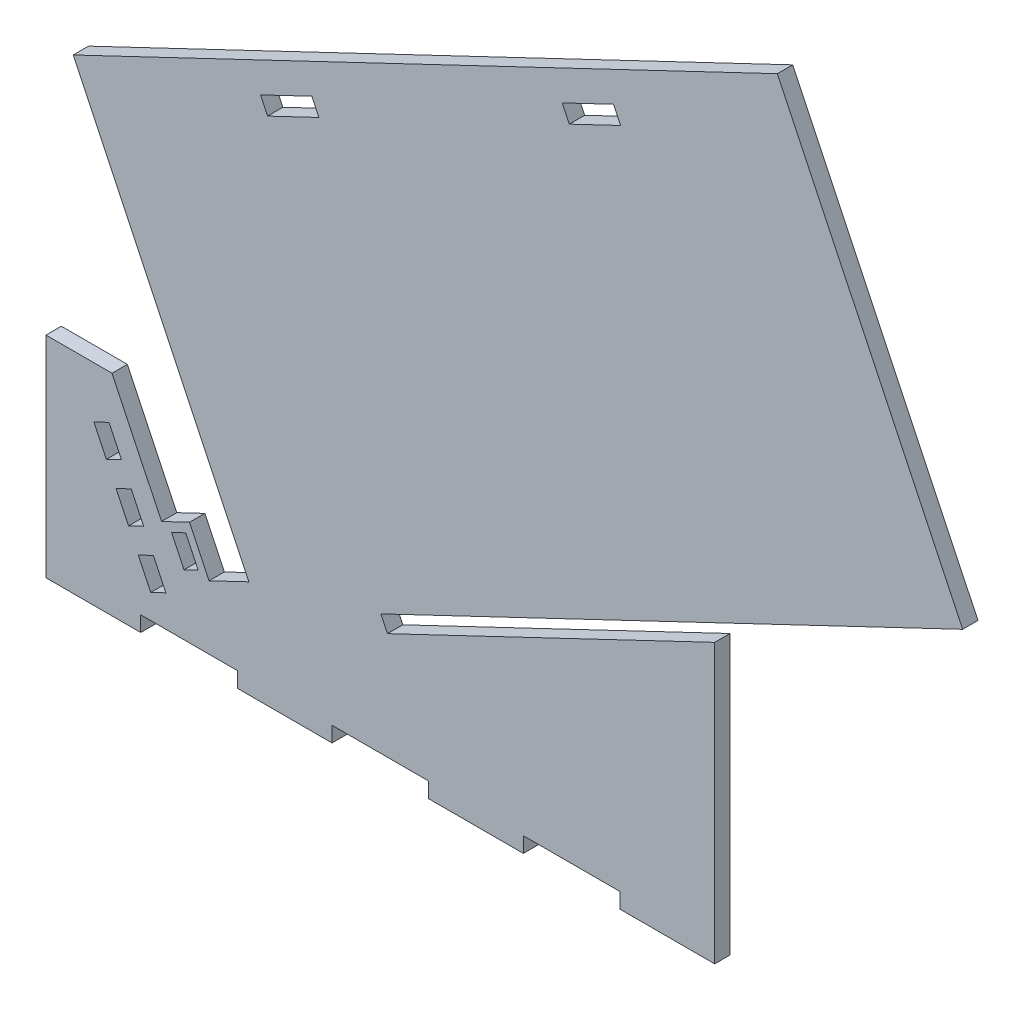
SolidWorks part; units mm, degrees
ref_plane "Front Plane" through (0, 0, 0) normal (0, 0, 1) x (1, 0, 0)
ref_plane "Top Plane" through (0, 0, 0) normal (0, 1, 0) x (1, 0, 0)
ref_plane "Right Plane" through (0, 0, 0) normal (1, 0, 0) x (0, 0, -1)
sketch "Sketch1" plane through (0, 0, 0) normal (0, 0, 1) x (1, 0, 0)
  line L12 (-264.2572, -95.6581) -> (-230.2572, -95.6581)
  line L13 (-230.2572, -95.6581) -> (-230.2572, -90.1581)
  line L15 (-264.2572, -90.1581) -> (-264.2572, -95.6581)
  line L24 (-241.7419, -36.2998) -> (-237.4367, -45.3257)
  line L25 (-237.4367, -45.3257) -> (-242.4912, -47.7366)
  line L26 (-242.4912, -47.7366) -> (-246.7963, -38.7107)
  line L27 (-246.7963, -38.7107) -> (-241.7419, -36.2998)
  line L28 (-233.7774, -52.9977) -> (-229.4723, -62.0235)
  line L29 (-229.4723, -62.0235) -> (-234.5268, -64.4344)
  line L30 (-234.5268, -64.4344) -> (-238.8319, -55.4085)
  line L31 (-238.8319, -55.4085) -> (-233.7774, -52.9977)
  line L32 (-225.8129, -69.6955) -> (-221.5078, -78.7214)
  line L33 (-221.5078, -78.7214) -> (-226.5623, -81.1322)
  line L34 (-226.5623, -81.1322) -> (-230.8674, -72.1064)
  line L35 (-230.8674, -72.1064) -> (-225.8129, -69.6955)
  line L44 (-195.5972, -95.6581) -> (-161.5972, -95.6581)
  line L45 (-195.5972, -90.1581) -> (-195.5972, -95.6581)
  line L47 (-161.5972, -95.6581) -> (-161.5972, -90.1581)
  line L52 (-24.2572, -95.6581) -> (-58.2572, -95.6581)
  line L53 (-58.2572, -95.6581) -> (-58.2572, -90.1581)
  line L55 (-24.2572, -90.1581) -> (-24.2572, -95.6581)
  line L56 (-92.9172, -95.6581) -> (-126.9172, -95.6581)
  line L57 (-126.9172, -95.6581) -> (-126.9172, -90.1581)
  line L59 (-92.9172, -90.1581) -> (-92.9172, -95.6581)
  line L61 (-264.2572, -90.1581) -> (-264.2572, -20.2081)
  line L62 (-264.2572, -20.2081) -> (-240.5538, -20.2081)
  line L63 (-240.5538, -20.2081) -> (-222.803, -57.4233)
  line L64 (-205.7276, -67.3141) -> (-191.4252, -60.4922)
  line L65 (-191.4252, -60.4922) -> (-254.494, 71.7343)
  line L66 (-230.2572, -90.1581) -> (-195.5972, -90.1581)
  line L67 (-161.5972, -90.1581) -> (-126.9172, -90.1581)
  line L68 (-58.2572, -90.1581) -> (-92.9172, -90.1581)
  line L70 (-254.494, 71.7343) -> (-1.7701, 192.2774)
  line L71 (-219.5762, -82.783) -> (-144.0813, -46.7738) construction
  line L80 (-78.6977, 144.5056) -> (-60.646, 153.1158)
  line L81 (-60.646, 153.1158) -> (-58.2782, 148.1516)
  line L82 (-58.2782, 148.1516) -> (-76.3299, 139.5414)
  line L83 (-76.3299, 139.5414) -> (-78.6977, 144.5056)
  line L84 (-187.0079, 92.8442) -> (-168.9562, 101.4545)
  line L85 (-168.9562, 101.4545) -> (-166.5884, 96.4902)
  line L86 (-166.5884, 96.4902) -> (-184.6401, 87.88)
  line L87 (-184.6401, 87.88) -> (-187.0079, 92.8442)
  line L88 (-24.2572, -90.1581) -> (-24.2572, 4.2831)
  line L89 (-144.0757, -46.7738) -> (-141.7079, -51.738)
  line L92 (-141.7079, -51.738) -> (-24.2572, 4.2831)
  line L93 (-144.0757, -46.7738) -> (64.7438, 52.828)
  line L94 (64.7438, 52.828) -> (-1.7701, 192.2774)
  line L106 (-237.1701, -45.4201) -> (-242.5856, -48.0032)
  line L107 (-242.5856, -48.0032) -> (-247.063, -38.6163)
  line L108 (-247.063, -38.6163) -> (-241.6474, -36.0332)
  line L109 (-241.6474, -36.0332) -> (-237.1701, -45.4201)
  line L110 (-229.2057, -62.1179) -> (-234.6212, -64.701)
  line L111 (-234.6212, -64.701) -> (-239.0985, -55.3141)
  line L112 (-239.0985, -55.3141) -> (-233.683, -52.7311)
  line L113 (-233.683, -52.7311) -> (-229.2057, -62.1179)
  line L114 (-231.134, -72.012) -> (-225.7185, -69.4289)
  line L115 (-225.7185, -69.4289) -> (-221.2412, -78.8158)
  line L116 (-221.2412, -78.8158) -> (-226.6567, -81.3988)
  line L117 (-226.6567, -81.3988) -> (-231.134, -72.012)
  line L118 (-166.3218, 96.3958) -> (-184.7345, 87.6134)
  line L119 (-184.7345, 87.6134) -> (-187.2746, 92.9387)
  line L120 (-187.2746, 92.9387) -> (-168.8618, 101.7211)
  line L121 (-168.8618, 101.7211) -> (-166.3218, 96.3958)
  line L122 (-58.0116, 148.0572) -> (-76.4243, 139.2747)
  line L123 (-76.4243, 139.2747) -> (-78.9643, 144.6)
  line L124 (-78.9643, 144.6) -> (-60.5516, 153.3824)
  line L125 (-60.5516, 153.3824) -> (-58.0116, 148.0572)
  line L126 (-222.803, -57.4233) -> (-212.7356, -52.6214)
  line L127 (-212.7356, -52.6214) -> (-205.7276, -67.3141)
  line L128 (-219.2063, -59.0316) -> (-214.1518, -56.6207)
  line L129 (-214.1518, -56.6207) -> (-209.6745, -66.0076)
  line L130 (-209.6745, -66.0076) -> (-214.729, -68.4185)
  line L131 (-214.729, -68.4185) -> (-219.2063, -59.0316)
  dimension "D3" = 8
  dimension "D4" = 8
  dimension "D6" = 10
  dimension "D9" = 10.4
extrude "Boss-Extrude1" add sketch "Sketch1" along normal blind 5.5 contours L93 L94 L70 L65 L64 L63 L62 L61 L15 L12 L13 L66 L45 L44 L47 L67 L57 L56 L59 L68 L53 L52 L55 L88 L92 L89 L120 L121 L118 L119 L112 L113 L110 L111 L108 L109 L106 L107 L116 L117 L114 L115 L124 L125 L122 L123
